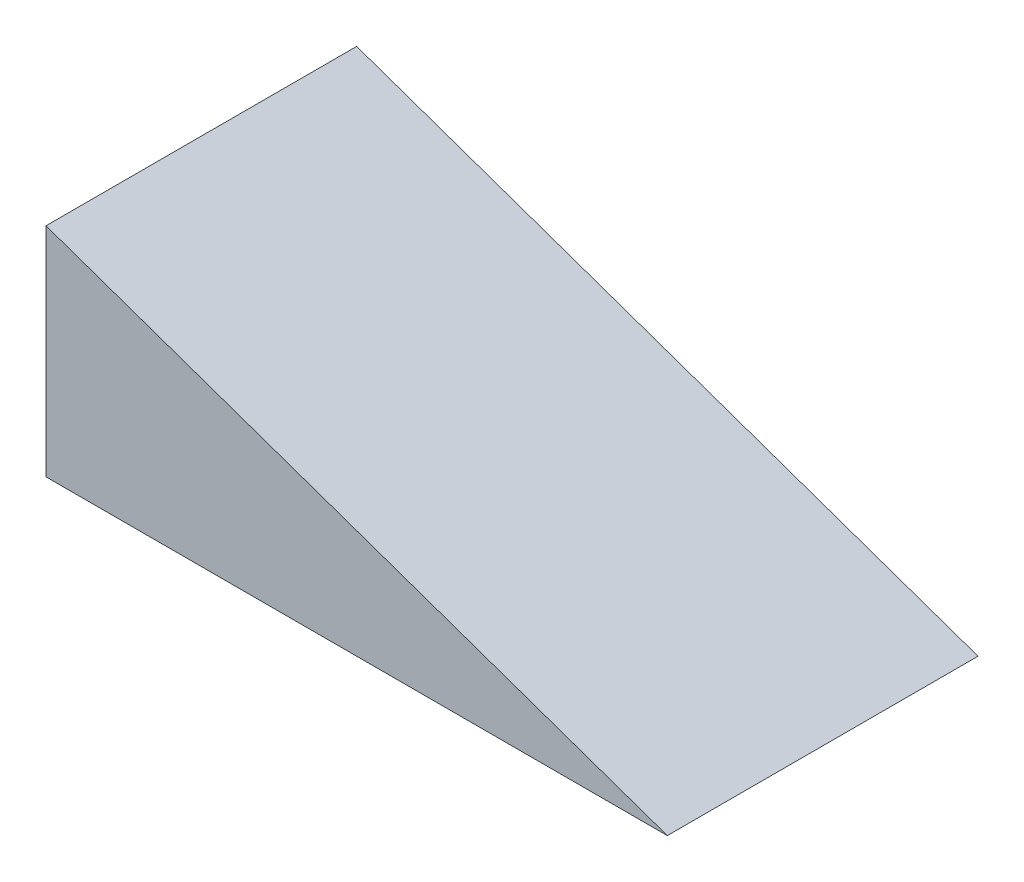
SolidWorks part; units mm, degrees
ref_plane "Vorderansicht" through (0, 0, 0) normal (0, 0, 1) x (1, 0, 0)
ref_plane "Oben" through (0, 0, 0) normal (0, 1, 0) x (1, 0, 0)
ref_plane "Rechts" through (0, 0, 0) normal (1, 0, 0) x (0, 0, -1)
sketch "Skizze1" plane through (0, 0, 0) normal (0, 0, 1) x (1, 0, 0)
  line L0 (0, 70) -> (200, 0)
  line L1 (0, 0) -> (200, 0)
  line L2 (0, 0) -> (0, 70)
  dimension "D1" = 200
  dimension "D2" = 70
extrude "Aufsatz-Linear austragen1" add sketch "Skizze1" along normal blind 100
